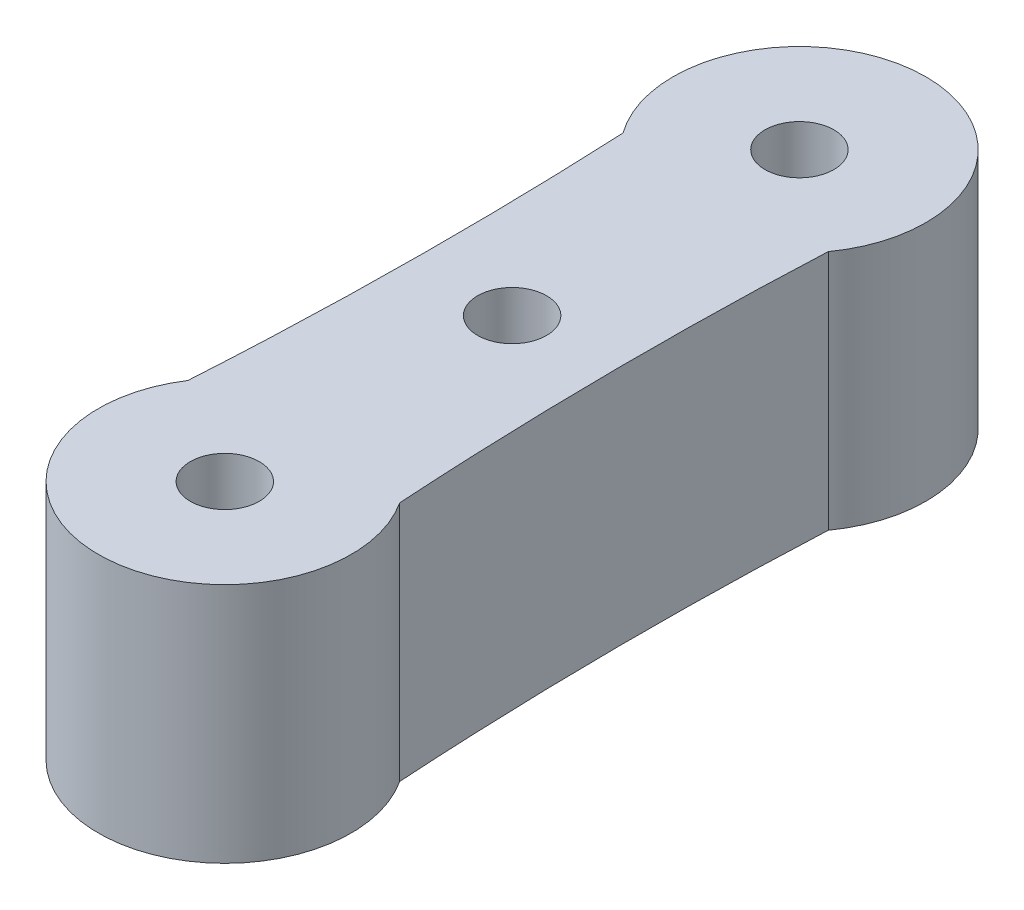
SolidWorks part; units mm, degrees
ref_plane "Front Plane" through (0, 0, 0) normal (0, 0, 1) x (1, 0, 0)
ref_plane "Top Plane" through (0, 0, 0) normal (0, 1, 0) x (1, 0, 0)
ref_plane "Right Plane" through (0, 0, 0) normal (1, 0, 0) x (0, 0, -1)
sketch "Sketch1" plane through (0, 0, 0) normal (0, 1, 0) x (1, 0, 0)
  line L0 (0, -12.5) -> (0, 12.5)
  circle A0 centre (0, 12.5) radius 5.5
  circle A1 centre (0, -12.5) radius 5.5
  circle A2 centre (0, 12.5) radius 4.1
  circle A3 centre (0, -12.5) radius 4.1
  circle A4 centre (0, 12.5) radius 1.5
  circle A5 centre (0, -12.5) radius 1.5
  spline S0 degree 2 poles (-4.4662, 9.2901) (-4.0223, -0.1078) (-4.6083, -9.4977) knots 0 0 0 1 1 1
  spline S1 degree 2 poles (4.4662, 9.2901) (4.0223, -0.1078) (4.6083, -9.4977) knots 0 0 0 1 1 1
  point P4 (0, 0)
  point P15 (4.2806, -0.214)
  dimension "D2" = 11
  dimension "D3" = 11
  dimension "D4" = 8.2
  dimension "D5" = 8.2
  dimension "D6" = 3
  dimension "D7" = 3
  dimension "D1" = 25
extrude "Boss-Extrude1" add sketch "Sketch1" along normal blind 10.5
sketch "Sketch4" plane through (0, 0, 0) normal (0, -1, 0) x (1, 0, 0)
  circle A0 centre (0, 0) radius 1.5
  dimension "D1" = 3
extrude "Cut-Extrude1" cut sketch "Sketch4" against normal blind 13
sketch "Sketch5" plane through (0, 0, 0) normal (0, -1, 0) x (1, 0, 0)
  circle A0 centre (0, 12.5) radius 3
  circle A1 centre (0, -12.5) radius 3
  circle A2 centre (0, 12.5) radius 1.5
  circle A3 centre (0, -12.5) radius 1.5
  circle A4 centre (0, 0) radius 3
  dimension "D1" = 6
  dimension "D2" = 3
  dimension "D3" = 6
extrude "Cut-Extrude3" cut sketch "Sketch5" against normal blind 3.5
